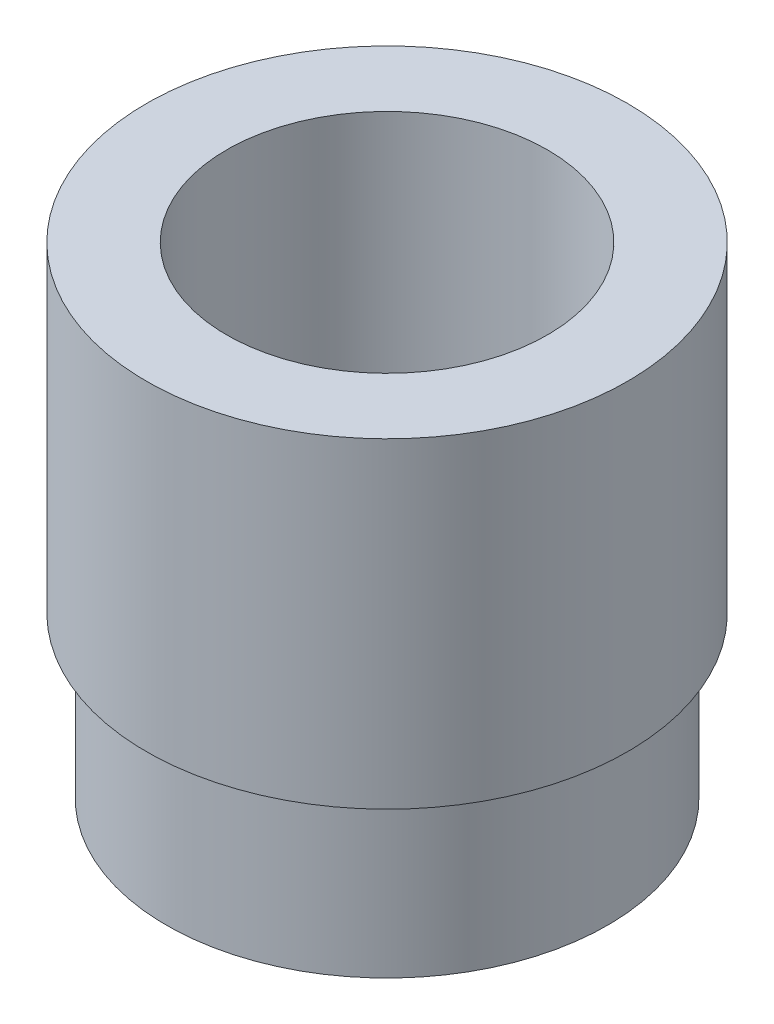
SolidWorks part; units mm, degrees
ref_plane "Front Plane" through (0, 0, 0) normal (0, 0, 1) x (1, 0, 0)
ref_plane "Top Plane" through (0, 0, 0) normal (0, 1, 0) x (1, 0, 0)
ref_plane "Right Plane" through (0, 0, 0) normal (1, 0, 0) x (0, 0, -1)
sketch "Sketch1" plane through (0, 0, 0) normal (1, 0, 0) x (0, 0, -1)
  line L0 (0, 0) -> (0, 39.1534) construction
  line L1 (19.05, 25.4) -> (19.05, 0)
  line L2 (19.05, 0) -> (17.4625, 0)
  line L3 (17.4625, 0) -> (17.4625, -12.7)
  line L4 (17.4625, -12.7) -> (12.7, -12.7)
  line L5 (12.7, -12.7) -> (12.7, 25.4)
  line L6 (12.7, 25.4) -> (19.05, 25.4)
  dimension "D1" = 25.4
  dimension "D2" = 38.1
  dimension "D3" = 34.925
  dimension "D4" = 12.7
  dimension "D5" = 38.1
revolve "Revolve1" add sketch "Sketch1" angle 360 about L0
